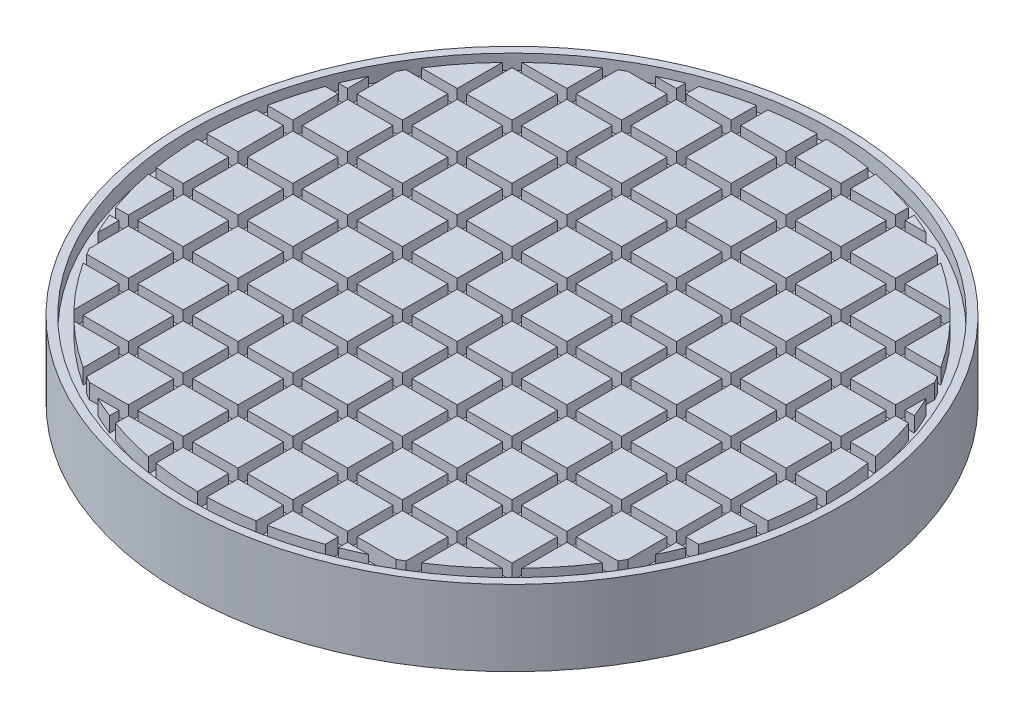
SolidWorks part; units mm, degrees
ref_plane "Front Plane" through (0, 0, 0) normal (0, 0, 1) x (1, 0, 0)
ref_plane "Top Plane" through (0, 0, 0) normal (0, 1, 0) x (1, 0, 0)
ref_plane "Right Plane" through (0, 0, 0) normal (1, 0, 0) x (0, 0, -1)
sketch "Sketch2" plane through (0, 0, 0) normal (0, 1, 0) x (1, 0, 0)
  circle A0 centre (0, 0) radius 82
extrude "Boss-Extrude1" add sketch "Sketch2" along normal blind 20
sketch "Sketch3" plane through (0, 20, 0) normal (0, 1, 0) x (1, 0, 0)
  line L0 (-82, 0) -> (82, 0)
  line L1 (0, -82) -> (0, 82)
  line L2 (-82, 14.5) -> (82, 14.5)
  line L3 (-82, 29) -> (82, 29)
  line L4 (-82, 43.5) -> (82, 43.5)
  line L5 (-82, 58) -> (82, 58)
  line L6 (-82, 0) -> (-82, 14.5) construction
  line L7 (-82, 72.5) -> (82, 72.5)
  line L8 (-82, 87) -> (82, 87)
  line L9 (-82, 101.5) -> (82, 101.5)
  line L10 (-82, -14.5) -> (82, -14.5)
  line L11 (-82, -29) -> (82, -29)
  line L12 (-82, -43.5) -> (82, -43.5)
  line L13 (-82, -58) -> (82, -58)
  line L14 (-82, 0) -> (-82, -14.5) construction
  line L15 (-82, -72.5) -> (82, -72.5)
  line L16 (-82, -87) -> (82, -87)
  line L17 (-82, -101.5) -> (82, -101.5)
  line L18 (14.5, -82) -> (14.5, 82)
  line L19 (29, -82) -> (29, 82)
  line L20 (43.5, -82) -> (43.5, 82)
  line L21 (58, -82) -> (58, 82)
  line L22 (0, -82) -> (14.5, -82) construction
  line L23 (72.5, -82) -> (72.5, 82)
  line L24 (87, -82) -> (87, 82)
  line L25 (101.5, -82) -> (101.5, 82)
  line L26 (-14.5, -82) -> (-14.5, 82)
  line L27 (-29, -82) -> (-29, 82)
  line L28 (-43.5, -82) -> (-43.5, 82)
  line L29 (-58, -82) -> (-58, 82)
  line L30 (-72.5, -82) -> (-72.5, 82)
  line L31 (0, -82) -> (-14.5, -82) construction
  line L32 (-87, -82) -> (-87, 82)
  line L33 (-101.5, -82) -> (-101.5, 82)
  circle A0 centre (0, 0) radius 82 construction
  point P2 (-82, 14.5)
  point P6 (0, 0)
  point P10 (0, 0)
  point P70 (-82, 0)
extrude "Cut-Extrude-Thin1" cut sketch "Sketch3" against normal blind 4 thin
sketch "Sketch7" plane through (0, 0, 0) normal (0, -1, 0) x (1, 0, 0)
  circle A0 centre (0, 0) radius 87.2
  circle A1 centre (0, 0) radius 82 construction
  circle A2 centre (0, 0) radius 82
extrude "Boss-Extrude4" add sketch "Sketch7" against normal blind 20
sketch "Sketch9" plane through (0, 20, 0) normal (0, 1, 0) x (1, 0, 0)
  circle A0 centre (0, 0) radius 82
  circle A1 centre (0, 0) radius 85
extrude "Cut-Extrude2" cut sketch "Sketch9" against normal blind 4
equation "\"PlateDiameter\"= 174.4"
equation "\"SquareSize\" = 12.0"
equation "\"GrooveOutside\"= 3"
equation "\"GrooveInside\" = 2.5"
equation "\"GrooveNumber\"= 8"
equation "\"D1@Sketch2\"=\"SquareDiameter\""
equation "\"GrooveDepth\"= 4"
equation "\"D1@Sketch3\"=\"GrooveNumber\""
equation "\"D2@Sketch3\"=\"SquareSize\"+\"GrooveInside\""
equation "\"D4@Sketch3\"=\"SquareSize\"+\"GrooveInside\""
equation "\"D3@Sketch3\"=\"GrooveNumber\""
equation "\"D6@Sketch3\"=\"SquareSize\"+\"GrooveInside\""
equation "\"D5@Sketch3\"=\"GrooveNumber\""
equation "\"D8@Sketch3\"=\"SquareSize\"+\"GrooveInside\""
equation "\"D7@Sketch3\"=\"GrooveNumber\""
equation "\"D5@Cut-Extrude-Thin1\"=\"GrooveInside\""
equation "\"D1@Cut-Extrude-Thin1\"=\"GrooveDepth\""
equation "\"PlateThickness\"= 20"
equation "\"D1@Boss-Extrude1\"=\"PlateThickness\""
equation "\"D1@Sketch7\"=\"PlateDiameter\""
equation "\"SquareDiameter\" =164"
equation "\"D2@Sketch9\"=\"GrooveOutside\""
equation "\"D1@Cut-Extrude2\"=\"GrooveDepth\""
